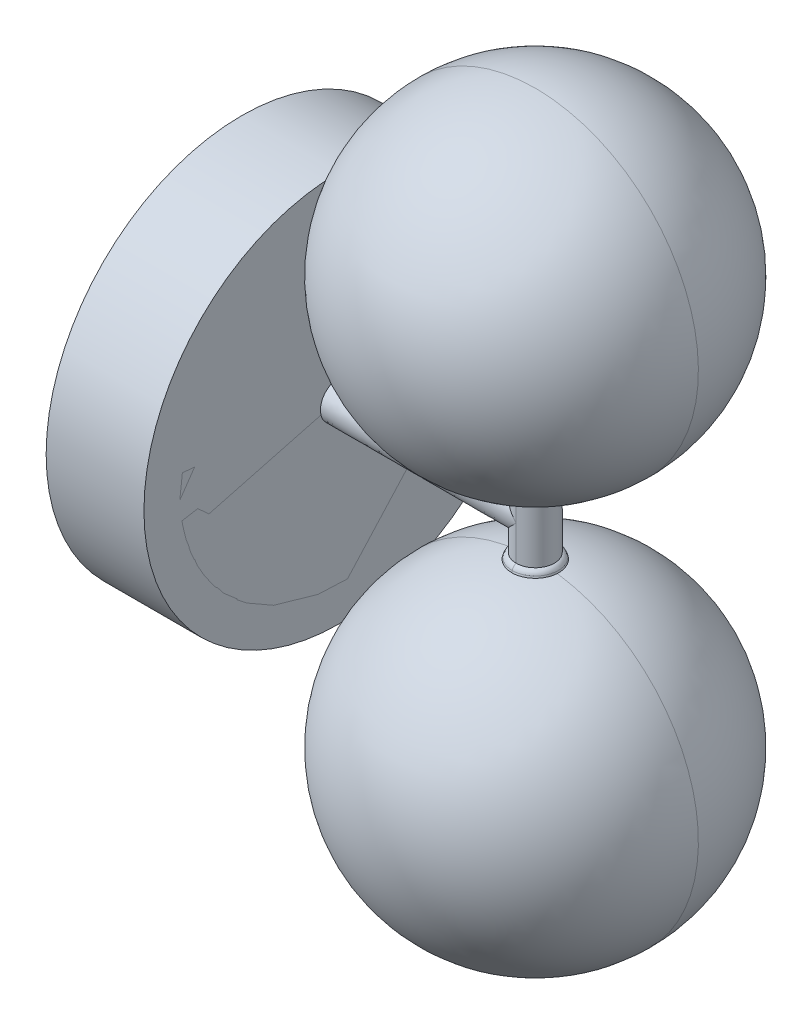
SolidWorks part; units mm, degrees
ref_plane "Alzado" through (0, 0, 0) normal (0, 0, 1) x (1, 0, 0)
ref_plane "Planta" through (0, 0, 0) normal (0, 1, 0) x (1, 0, 0)
ref_plane "Vista lateral" through (0, 0, 0) normal (1, 0, 0) x (0, 0, -1)
imported_body "A1280.IGS<1>"
delete or keep bodies "Sólido-Eliminar/Conservar 1" type delete bodies bodies 107
ref_plane "Plano2" through (-60, 0, 0) normal (1, 0, 0) x (0, 0, -1)
sketch "Croquis2" plane through (-60, 0, 0) normal (1, 0, 0) x (0, 0, -1)
  circle A0 centre (0, 62.8184) radius 59.944
  dimension "D1" = 119.888
extrude "Saliente-Extruir1" add sketch "Croquis2" against normal blind 29.972
